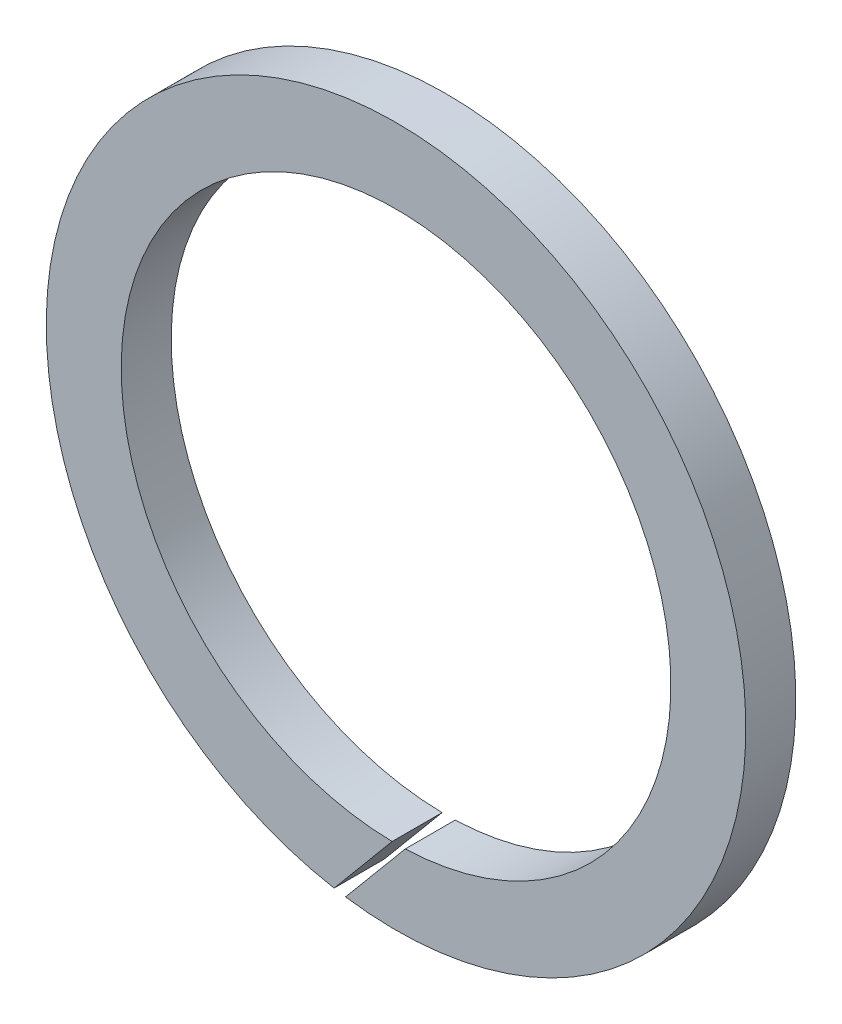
SolidWorks part; units mm, degrees
ref_plane "Plan de face" through (0, 0, 0) normal (0, 0, 1) x (1, 0, 0)
ref_plane "Plan de dessus" through (0, 0, 0) normal (0, 1, 0) x (1, 0, 0)
ref_plane "Plan de droite" through (0, 0, 0) normal (1, 0, 0) x (0, 0, -1)
sketch "Esquisse1" plane through (0, 0, 0) normal (0, 0, 1) x (1, 0, 0)
  circle A0 centre (0, 0) radius 7
  circle A1 centre (0, 0) radius 5.5
  dimension "D1" = 14
  dimension "D2" = 11
extrude "Boss.-Extru.1" add sketch "Esquisse1" along normal blind 1
sketch "Esquisse2" plane through (0, 0, 1) normal (0, 0, 1) x (1, 0, 0)
  line L0 (0.8851, -4.3467) -> (-1.9189, -7.7003)
  line L1 (-1.9189, -7.7003) -> (-1.6582, -7.7003)
  line L2 (-1.6582, -7.7003) -> (1.4921, -3.9325)
  line L3 (1.4921, -3.9325) -> (0.8851, -4.3467)
  dimension "D1" = 0.2
extrude "Enlèv. mat.-Extru.1" cut sketch "Esquisse2" against normal through all
